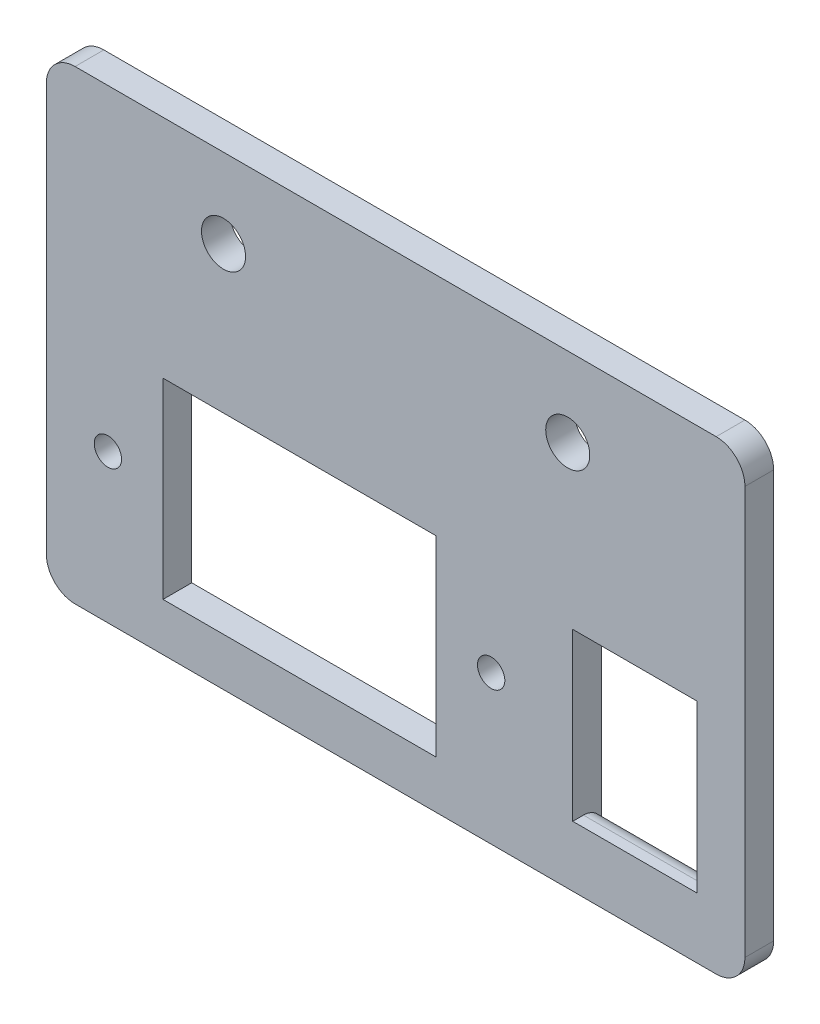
SolidWorks part; units mm, degrees
ref_plane "Front Plane" through (0, 0, 0) normal (0, 0, 1) x (1, 0, 0)
ref_plane "Top Plane" through (0, 0, 0) normal (0, 1, 0) x (1, 0, 0)
ref_plane "Right Plane" through (0, 0, 0) normal (1, 0, 0) x (0, 0, -1)
ref_plane "Plane1" through (0, 0, 0) normal (0, 0, -1) x (-1, 0, 0)
ref_plane "Plane2" through (0, 0, 3.8) normal (0, 0, -1) x (-1, 0, 0)
sketch "Sketch18" plane through (0, 0, 0) normal (0, 0, 1) x (1, 0, 0)
  line L1 (-23.75, 10) -> (4.75, 10)
  line L2 (-23.75, 10) -> (-23.75, -10)
  line L3 (-23.75, -10) -> (4.75, -10)
  line L4 (4.75, 10) -> (4.75, -10)
  line L5 (19.015, 8.6756) -> (31.985, 8.6756)
  line L6 (19.015, 8.6756) -> (19.015, -8.6756)
  line L7 (19.015, -8.6756) -> (31.985, -8.6756)
  line L8 (31.985, 8.6756) -> (31.985, -8.6756)
  line L11 (-35.9266, 0.5) -> (-35.9266, 33.5776)
  line L12 (0, 33.5776) -> (-35.9266, 33.5776)
  line L14 (-35.9266, 0.5) -> (-35.9266, -15)
  line L15 (-9.5, -15) -> (-35.9266, -15)
  line L16 (36.985, 0) -> (36.985, -15)
  line L17 (-9.5, -15) -> (36.985, -15)
  line L19 (-35.9266, 33.5776) -> (36.985, 33.5776)
  line L20 (-35.9266, 33.5776) -> (-35.9266, -15)
  line L21 (-35.9266, -15) -> (36.985, -15)
  line L22 (36.985, 33.5776) -> (36.985, -15)
  line L166 (31.985, -8.6756) -> (31.985, 8.6756)
  line L168 (19.015, 8.6756) -> (19.015, -8.6756)
  line L178 (4.75, 10) -> (-23.75, 10)
  line L190 (-23.75, -10) -> (4.75, -10)
  line L206 (4.75, -10) -> (4.75, 10)
  line L211 (-23.75, 10) -> (-23.75, -10)
  line L215 (31.985, -8.6756) -> (19.015, -8.6756)
  line L219 (19.015, 8.6756) -> (31.985, 8.6756)
  circle A0 centre (-17.9633, 25) radius 2.3
  circle A1 centre (10.5, 0.5) radius 1.4266
  circle A2 centre (-29.5, 0.5) radius 1.4266
  circle A4 centre (18.4925, 25) radius 2.3
extrude "Boss-Extrude1" add sketch "Sketch18" along normal blind 3 contours L22 L19 L12 L11 L14 L15 L17 L16 A4 A2 A1 A0 L1 L4 L3 L2 L5 L8 L7 L6
sketch "Sketch19" plane through (0, 0, 0) normal (0, 0, -1) x (-1, 0, 0)
  line L0 (-33.985, 10.3) -> (32.9266, 10.3)
  line L2 (32.9266, 10.3) -> (32.9266, -12)
  line L3 (9.5, -12) -> (32.9266, -12)
  line L4 (9.5, -12) -> (-33.985, -12)
  line L5 (9.5, -15) -> (-36.985, -15)
  line L6 (-36.985, 13.3) -> (-36.985, -15)
  line L7 (-33.985, 10.3) -> (-33.985, -12)
  line L9 (9.5, -15) -> (35.9266, -15)
  line L10 (35.9266, 13.3) -> (35.9266, -15)
  line L15 (-36.985, 13.3) -> (35.9266, 13.3)
  dimension "D1" = 3
extrude "Boss-Extrude3" add sketch "Sketch19" along normal blind 21
sketch "Sketch20" plane through (0, 0, 0) normal (0, 0, -1) x (-1, 0, 0)
  line L0 (-36.985, 13.3) -> (-36.985, 15.3)
  line L1 (-36.985, 33.5776) -> (-36.985, 13.3) construction
  line L2 (30.9266, 10.3) -> (30.9266, -10)
  line L3 (-36.985, 15.3) -> (35.9266, 15.3)
  line L4 (-36.985, 15.3) -> (-36.985, 13.3)
  line L5 (-36.985, 15.3) -> (35.9266, 15.3)
  line L6 (35.9266, 15.3) -> (35.9266, 13.3)
  line L7 (-36.985, 15.3) -> (35.9266, 15.3)
  line L8 (-36.985, 15.3) -> (-36.985, -15)
  line L9 (-36.985, -15) -> (35.9266, -15)
  line L10 (35.9266, 15.3) -> (35.9266, -15)
  line L11 (-36.985, 15.3) -> (-36.985, -15)
  line L12 (-36.985, -15) -> (35.9266, -15)
  line L13 (35.9266, 15.3) -> (35.9266, -15)
  line L14 (-31.985, 10.3) -> (30.9266, 10.3)
  line L15 (-31.985, 10.3) -> (-31.985, -10)
  line L16 (-31.985, -10) -> (30.9266, -10)
  line L17 (-31.985, 15.3) -> (-31.985, -15) construction
  line L18 (-36.985, 10.3) -> (35.9266, 10.3) construction
  line L19 (-36.985, -10) -> (35.9266, -10) construction
  line L20 (30.9266, 15.3) -> (30.9266, -15) construction
  dimension "D1" = 5
  dimension "D2" = 5
extrude "Boss-Extrude4" add sketch "Sketch20" along normal blind 21 contours L3 M6 M3 M4 | L10 L8 L9 L16 L15 L14 L2 M3
fillet "Fillet1" radius 3 7 edges at (36.985, -15, -9) (-35.9266, -15, -9) (-35.9266, 33.5776, 1.5) (36.985, 33.5776, 1.5) (36.985, 15.3, -10.5) (-35.9266, 15.3, -10.5)
sketch "Sketch23" plane through (0, 0, -21) normal (0, 0, -1) x (-1, 0, 0)
  line L0 (30.9266, 10.3) -> (-31.985, 10.3) construction
  line L1 (-31.985, 10.3) -> (-31.985, -10) construction
  line L2 (-31.985, -10) -> (30.9266, -10) construction
  line L3 (30.9266, 10.3) -> (30.9266, -10) construction
  line L4 (35.9266, -12) -> (35.9266, 12.3)
  line L5 (32.9266, 15.3) -> (-33.985, 15.3)
  line L6 (-36.985, 12.3) -> (-36.985, -12)
  line L7 (-33.985, -15) -> (32.9266, -15)
  line L8 (35.9266, -12) -> (35.9266, 12.3)
  line L9 (32.9266, 15.3) -> (-33.985, 15.3)
  line L10 (-36.985, 12.3) -> (-36.985, -12)
  line L11 (-33.985, -15) -> (32.9266, -15)
  line L12 (30.9266, 10.3) -> (-31.985, 10.3)
  line L13 (-31.985, 10.3) -> (-31.985, -10)
  line L14 (-31.985, -10) -> (30.9266, -10)
  line L15 (30.9266, 10.3) -> (30.9266, -10)
  arc A4 (35.9266, 12.3) -> (32.9266, 15.3) centre (32.9266, 12.3) ccw
  arc A5 (-33.985, 15.3) -> (-36.985, 12.3) centre (-33.985, 12.3) ccw
  arc A6 (-36.985, -12) -> (-33.985, -15) centre (-33.985, -12) ccw
  arc A7 (32.9266, -15) -> (35.9266, -12) centre (32.9266, -12) ccw
  arc A8 (35.9266, 12.3) -> (32.9266, 15.3) centre (32.9266, 12.3) ccw
  arc A9 (-33.985, 15.3) -> (-36.985, 12.3) centre (-33.985, 12.3) ccw
  arc A10 (-36.985, -12) -> (-33.985, -15) centre (-33.985, -12) ccw
  arc A11 (32.9266, -15) -> (35.9266, -12) centre (32.9266, -12) ccw
  dimension "D1" = 0
sketch "Sketch24" plane through (-35.9266, 0, 0) normal (-1, 0, 0) x (0, 0, 1)
  line L9 (-12.9375, 4.0023) -> (-12.9375, 4.15)
  circle A0 centre (-15.8063, 0.5352) radius 4.5
extrude "Cut-Extrude3" cut sketch "Sketch24" against normal blind 10 contours A0
extrude "Boss-Extrude7" add sketch "Sketch23" along normal blind 3
sketch "Sketch25" plane through (0, 0, -24) normal (0, 0, -1) x (-1, 0, 0)
  line L4 (35.9266, -12) -> (35.9266, 12.3)
  line L5 (32.9266, 15.3) -> (-33.985, 15.3)
  line L6 (-36.985, 12.3) -> (-36.985, -12)
  line L7 (-33.985, -15) -> (32.9266, -15)
  line L8 (35.9266, -12) -> (35.9266, 12.3)
  line L9 (32.9266, 15.3) -> (-33.985, 15.3)
  line L10 (-36.985, 12.3) -> (-36.985, -12)
  line L11 (-33.985, -15) -> (32.9266, -15)
  arc A4 (32.9266, -15) -> (35.9266, -12) centre (32.9266, -12) ccw
  arc A5 (35.9266, 12.3) -> (32.9266, 15.3) centre (32.9266, 12.3) ccw
  arc A6 (-33.985, 15.3) -> (-36.985, 12.3) centre (-33.985, 12.3) ccw
  arc A7 (-36.985, -12) -> (-33.985, -15) centre (-33.985, -12) ccw
  arc A8 (32.9266, -15) -> (35.9266, -12) centre (32.9266, -12) ccw
  arc A9 (35.9266, 12.3) -> (32.9266, 15.3) centre (32.9266, 12.3) ccw
  arc A10 (-33.985, 15.3) -> (-36.985, 12.3) centre (-33.985, 12.3) ccw
  arc A11 (-36.985, -12) -> (-33.985, -15) centre (-33.985, -12) ccw
  dimension "D1" = 0
extrude "Boss-Extrude8" add sketch "Sketch25" along normal blind 1.5
fillet "Fillet2" radius 2 1 edges at (25.5, 8.6756, 0)
fillet "Fillet3" radius 2 1 edges at (25.5, -8.6756, 0)
sketch "Sketch27" plane through (0, 0, 0) normal (0, 0, -1) x (-1, 0, 0)
  circle A1 centre (-18.4925, 25.3) radius 2.3
  circle A2 centre (17.4341, 25.3) radius 2.3
sketch "Sketch28" plane through (0, 0, 3) normal (0, 0, 1) x (1, 0, 0)
  circle A0 centre (-17.9633, 25) radius 2.3 construction
  circle A1 centre (18.4925, 25) radius 2.3 construction
  circle A2 centre (-17.9633, 25) radius 2.3
  circle A3 centre (18.4925, 25) radius 2.3
extrude "Boss-Extrude9" add sketch "Sketch28" against normal blind 3
extrude "Cut-Extrude4" cut sketch "Sketch27" against normal blind 3
sketch "Sketch29" plane through (36.985, 0, 0) normal (1, 0, 0) x (0, 0, -1)
  line L1 (0, 15.3) -> (25.5, 15.3)
  line L2 (0, 15.3) -> (0, -15)
  line L3 (0, -15) -> (25.5, -15)
  line L4 (25.5, 15.3) -> (25.5, -15)
extrude "Cut-Extrude6" cut sketch "Sketch29" against normal blind 77
